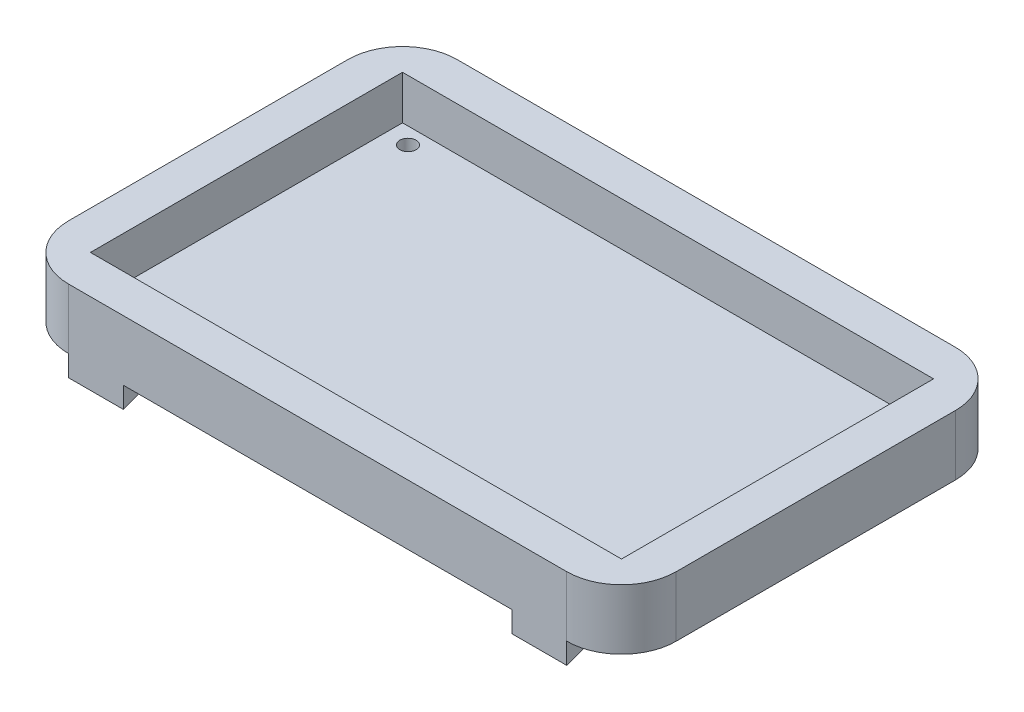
SolidWorks part; units mm, degrees
ref_plane "Plan de face" through (0, 0, 0) normal (0, 0, 1) x (1, 0, 0)
ref_plane "Plan de dessus" through (0, 0, 0) normal (0, 1, 0) x (1, 0, 0)
ref_plane "Plan de droite" through (0, 0, 0) normal (1, 0, 0) x (0, 0, -1)
sketch "Esquisse1" plane through (0, 0, 0) normal (0, 1, 0) x (1, 0, 0)
  line L1 (-40.4645, 24.9675) -> (56.5355, 24.9675)
  line L2 (-40.4645, 24.9675) -> (-40.4645, -32.0325)
  line L3 (-40.4645, -32.0325) -> (56.5355, -32.0325)
  line L4 (56.5355, 24.9675) -> (56.5355, -32.0325)
  dimension "D1" = 97
  dimension "D2" = 57
extrude "Boss.-Extru.1" add sketch "Esquisse1" along normal blind 3
sketch "Esquisse3" plane through (0, 0, 0) normal (0, 1, 0) x (1, 0, 0)
  line L1 (-40.4645, 24.9675) -> (-47.4645, 24.9675)
  line L2 (-40.4645, 24.9675) -> (-40.4645, -32.0325)
  line L3 (-40.4645, -32.0325) -> (-47.4645, -32.0325)
  line L4 (-47.4645, 24.9675) -> (-47.4645, -32.0325)
  dimension "D1" = 7
extrude "Boss.-Extru.2" add sketch "Esquisse3" along normal blind 11
sketch "Esquisse4" plane through (0, 0, 0) normal (0, 1, 0) x (1, 0, 0)
  line L1 (-47.4645, -32.0325) -> (56.5355, -32.0325)
  line L2 (-47.4645, -32.0325) -> (-47.4645, -39.0325)
  line L3 (-47.4645, -39.0325) -> (56.5355, -39.0325)
  line L4 (56.5355, -32.0325) -> (56.5355, -39.0325)
  dimension "D1" = 7
extrude "Boss.-Extru.3" add sketch "Esquisse4" along normal blind 11
sketch "Esquisse5" plane through (0, 0, 0) normal (0, 1, 0) x (1, 0, 0)
  line L1 (-47.4645, 24.9675) -> (56.5355, 24.9675)
  line L2 (-47.4645, 24.9675) -> (-47.4645, 31.9675)
  line L3 (-47.4645, 31.9675) -> (56.5355, 31.9675)
  line L4 (56.5355, 24.9675) -> (56.5355, 31.9675)
  dimension "D1" = 7
extrude "Boss.-Extru.4" add sketch "Esquisse5" along normal blind 11
sketch "Esquisse6" plane through (0, 0, 0) normal (0, 1, 0) x (1, 0, 0)
  line L1 (56.5355, 31.9675) -> (63.5355, 31.9675)
  line L2 (56.5355, 31.9675) -> (56.5355, -39.0325)
  line L3 (56.5355, -39.0325) -> (63.5355, -39.0325)
  line L4 (63.5355, 31.9675) -> (63.5355, -39.0325)
  dimension "D1" = 7
extrude "Boss.-Extru.5" add sketch "Esquisse6" along normal blind 11
sketch "Esquisse7" plane through (0, 3, 0) normal (0, 1, 0) x (1, 0, 0)
  circle A0 centre (-36.4645, 21.9675) radius 1.5
  circle A1 centre (-36.4705, -29.026) radius 1.5
  circle A4 centre (52.5355, 21.9675) radius 1.5
  circle A5 centre (52.5355, -28.6834) radius 1.5
extrude "Enlèv. mat.-Extru.3" cut sketch "Esquisse7" against normal blind 11
fillet "Congé1" radius 10 4 edges at (63.5355, 5.5, -31.9675) (63.5355, 5.5, 39.0325) (-47.4645, 5.5, -31.9675) (-47.4645, 5.5, 39.0325)
sketch "Esquisse8" plane through (0, 0, 0) normal (0, -1, 0) x (1, 0, 0)
  line L1 (-37.4645, 39.0325) -> (-27.4645, 39.0325)
  line L2 (-37.4645, 39.0325) -> (-37.4645, 35.335)
  line L3 (-37.4645, 35.335) -> (-27.4645, 35.335)
  line L4 (-27.4645, 39.0325) -> (-27.4645, 35.335)
  line L5 (53.5355, 39.0325) -> (43.5355, 39.0325)
  line L6 (53.5355, 39.0325) -> (53.5355, 35.335)
  line L7 (53.5355, 35.335) -> (43.5355, 35.335)
  line L8 (43.5355, 39.0325) -> (43.5355, 35.335)
  dimension "D1" = 10
  dimension "D2" = 10
extrude "Boss.-Extru.6" add sketch "Esquisse8" along normal blind 5
sketch "Esquisse11" plane through (-37.4645, 0, 0) normal (-1, 0, 0) x (0, 0, 1)
  line L0 (35.335, -2.5) -> (39.0325, -3.828)
  line L1 (35.335, -5) -> (35.335, 0) construction
  line L2 (39.0325, -5) -> (39.0325, 0) construction
  line L3 (39.0325, -3.828) -> (39.0325, -5)
  line L4 (39.0325, -5) -> (35.335, -5)
  line L5 (35.335, -5) -> (35.335, -2.5)
extrude "Enlèv. mat.-Extru.5" cut sketch "Esquisse11" against normal blind 109
